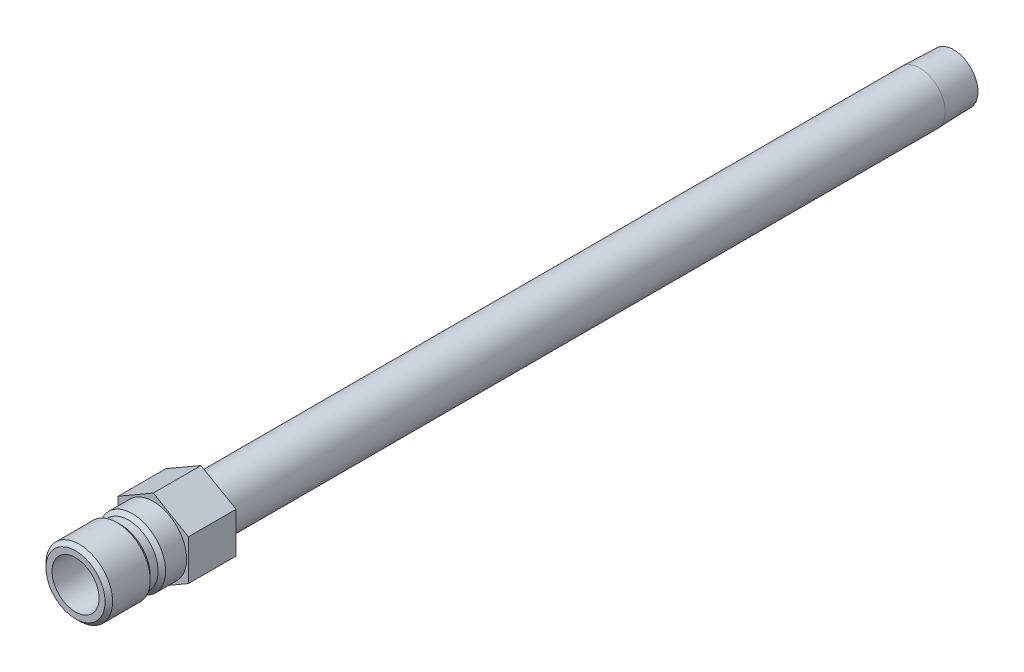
SolidWorks part; units mm, degrees
ref_plane "Front Plane" through (0, 0, 0) normal (0, 0, 1) x (1, 0, 0)
ref_plane "Top Plane" through (0, 0, 0) normal (0, 1, 0) x (1, 0, 0)
ref_plane "Right Plane" through (0, 0, 0) normal (1, 0, 0) x (0, 0, -1)
sketch "Sketch1" plane through (0, 0, 0) normal (1, 0, 0) x (0, 0, -1)
  line L0 (9.652, 0) -> (-18.923, 0) construction
  line L1 (-15.748, 4.7625) -> (-15.748, 5.9817)
  line L2 (-6.604, 5.9817) -> (-6.604, 0) construction
  line L3 (-14.986, 6.7437) -> (-7.366, 6.7437)
  line L4 (9.652, 5.1435) -> (9.652, 0) construction
  line L5 (-6.604, 5.9817) -> (-5.0165, 5.9817)
  line L6 (-4.2545, 6.7437) -> (9.652, 6.7437)
  line L7 (9.652, 6.7437) -> (9.652, 5.1435)
  line L8 (-6.604, 5.9817) -> (-7.366, 6.7437)
  line L9 (-5.0165, 5.9817) -> (-4.2545, 6.7437)
  line L10 (-15.748, 5.9817) -> (-14.986, 6.7437)
  line L11 (-15.748, 4.7625) -> (-3.556, 4.7625)
  line L12 (9.652, 5.1435) -> (155.194, 5.1435)
  line L13 (155.194, 5.1435) -> (162.052, 4.9292)
  line L14 (162.052, 4.9292) -> (162.052, 3.4163)
  line L15 (0, 0) -> (0, 6.7437) construction
  line L16 (9.652, 6.731) -> (9.652, 0) construction
  line L17 (-3.556, 4.7625) -> (-2.8402, 3.4163)
  line L19 (-2.8402, 3.4163) -> (162.052, 3.4163)
  dimension "D2" = 1.5875
  dimension "D3" = 0.762
  dimension "D4" = 45
  dimension "D5" = 9.144
  dimension "D6" = 45
  dimension "D7" = 1.79
  dimension "D8" = 6.858
  dimension "D9" = 177.8
  dimension "D10" = 3.175
  dimension "D11" = 9.525
  dimension "D12" = 10.287
  dimension "D13" = 25.4
  dimension "D14" = 13.4874
  dimension "D15" = 6.8326
  dimension "D16" = 12.192
  dimension "D17" = 9.652
  dimension "D18" = 118
revolve "Revolve1" add sketch "Sketch1" angle 360 about L0
sketch "Sketch2" plane through (0, 0, 0) normal (0, 0, 1) x (1, 0, 0)
  line L1 (-7.112, 4.1061) -> (-7.112, -4.1061)
  line L2 (-7.112, -4.1061) -> (0, -8.2122)
  line L3 (0, -8.2122) -> (7.112, -4.1061)
  line L4 (7.112, -4.1061) -> (7.112, 4.1061)
  line L5 (7.112, 4.1061) -> (0, 8.2122)
  line L6 (0, 8.2122) -> (-7.112, 4.1061)
  circle A0 centre (0, 0) radius 7.112 construction
  circle A1 centre (0, 0) radius 4.7625 construction
  circle A2 centre (0, 0) radius 4.7625
  dimension "D1" = 14.224
extrude "Boss-Extrude1" add sketch "Sketch2" against normal up to vertex (9.652 mm away)
